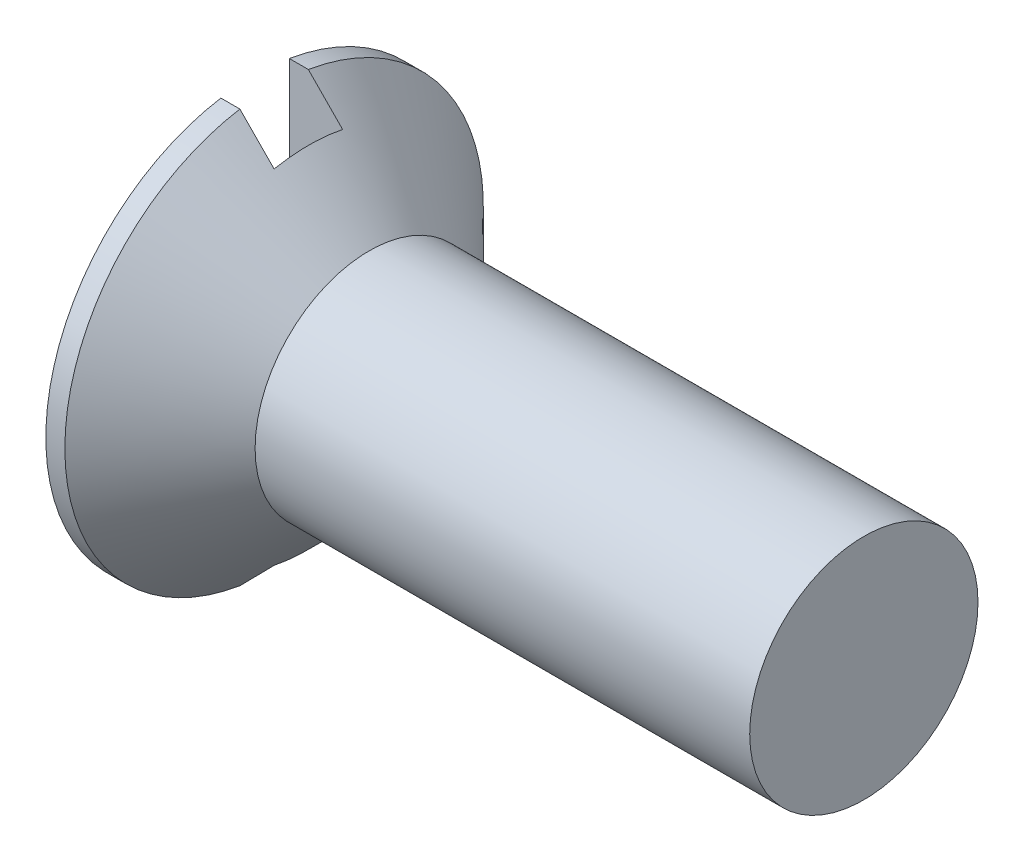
SolidWorks part; units mm, degrees
ref_plane "Plane1" through (0, 0, 0) normal (0, 0, 1) x (1, 0, 0)
ref_plane "Plane2" through (0, 0, 0) normal (0, 1, 0) x (1, 0, 0)
ref_plane "Plane3" through (0, 0, 0) normal (1, 0, 0) x (0, 0, -1)
sketch "BodySke" plane through (0, 0, 0) normal (0, 0, 1) x (1, 0, 0)
  line L0 (0, 0) -> (0, 5.5)
  line L1 (0, 5.5) -> (0.5, 5.5)
  line L2 (3, 3) -> (16, 3)
  line L3 (16, 3) -> (16, 0)
  line L4 (16, 0) -> (0, 0)
  line L5 (-6.35, 0) -> (82.55, 0) construction
  line L6 (3, -3) -> (16, -3) construction
  line L7 (0.5, -5.5) -> (3, -3) construction
  line L8 (0.5, 5.5) -> (3, 3)
  line L9 (0, -5.5) -> (0.5, -5.5) construction
  line L10 (4, 4.5875) -> (4, -4.9375) construction
  line L11 (0, 6.35) -> (0, -3.175) construction
  dimension "Diameter" = 6
  dimension "Length" = 16
  dimension "Head_ht" = 3
  dimension "Head_dia" = 11
  dimension "Head_ang" = 90
  dimension "D6" = 0.5
  dimension "Advance" = 1
  dimension "Thread_nom" = 16
revolve "Base-Revolve" add sketch "BodySke" angle 360 about L5
sketch "Sketch3" plane through (0, 0, 0) normal (-1, 0, 0) x (0, 0, 1)
  line L0 (-0.41, 3.25) -> (0.41, 3.25)
  line L1 (0.41, 3.25) -> (0.41, -3.25)
  line L2 (0.41, -3.25) -> (-0.41, -3.25)
  line L3 (-0.41, -3.25) -> (-0.41, 3.25)
  dimension "D1" = 3.25
  dimension "Cross_dia" = 6.5
  dimension "D2" = 0.41
  dimension "Cross_width" = 0.82
ref_plane "Plane4" through (2.7, 0, 0) normal (-1, 0, 0) x (0, 0, 1)
sketch "Sketch4" plane through (2.7, 0, 0) normal (-1, 0, 0) x (0, 0, 1)
  line L0 (-0.41, 1.9038) -> (0.41, 1.9038)
  line L3 (0.41, 1.9038) -> (0.41, -1.9038)
  line L4 (0.41, -1.9038) -> (-0.41, -1.9038)
  line L5 (-0.41, -1.9038) -> (-0.41, 1.9038)
  dimension "D1" = 0.82
  dimension "D2" = 3.8077
  dimension "D3" = 0.41
  dimension "D4" = 1.9038
loft "Recess" [suppressed] cut profiles "Sketch3", "Sketch4"
pattern_circular "RecPat" [suppressed] count 2 every 90 about axis through (-6.35, 0, 0) along (1, 0, 0)
sketch "RecCorSke" plane through (0, 0, 0) normal (0, 0, 1) x (1, 0, 0)
  line L0 (-3.175, 0) -> (15.875, 0) construction
  line L2 (0, 0) -> (0, 1.4693)
  line L3 (0, 1.4693) -> (2.7, 1.2805)
  line L4 (2.7, 1.2805) -> (3.1161, 0)
  line L5 (3.1161, 0) -> (0, 0)
  dimension "Diameter" = 2.561
  dimension "Depth" = 2.7
  dimension "Draft_angle" = 4
  dimension "Bottom_angle" = 18
revolve "RecessCore" [suppressed] cut sketch "RecCorSke" angle 360 about L0
sketch "Sketch5" plane through (0, 4.1645, -0.7173) normal (-1, 0, 0) x (0, 0, 1)
  line L0 (0.7173, -4.1645) -> (0.7173, 12.7) construction
  line L1 (1.6173, 1.2613) -> (1.6173, -9.5904)
  line L3 (-0.1827, -9.5904) -> (-0.1827, 1.2613)
  arc A0 (1.6173, 1.2613) -> (-0.1827, 1.2613) centre (0.7173, -4.1645) ccw
  circle A1 centre (0.7173, -4.1645) radius 5.5 construction
  arc A2 (-0.1827, -9.5904) -> (1.6173, -9.5904) centre (0.7173, -4.1645) ccw
  dimension "Slot_width" = 1.8
extrude "Slot" cut sketch "Sketch5" against normal blind 1.4
equation "\"D1@Sketch3\" = \"Cross_dia@Sketch3\" / 2"
equation "\"D2@Sketch3\" = \"Cross_width@Sketch3\" / 2"
equation "\"Depth@RecCorSke\" = \"Cross_depth@Plane4\""
equation "\"D1@Sketch4\" = \"Cross_width@Sketch3\""
equation "\"D2@Sketch4\" = \"Cross_dia@Sketch3\" - 2.0 * \"Cross_depth@Plane4\" * tan(26.5  * 0.017453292)"
equation "\"D3@Sketch4\" = \"D1@Sketch4\" / 2"
equation "\"D4@Sketch4\" = \"D2@Sketch4\" / 2"
equation "\"Thread_length@ThreadCosmetic\" = ((sgn( (\"Length@BodySke\" - \"Advance@BodySke\" * 1.0 - \"Head_ht@BodySke\" ) - \"Thread_nom@BodySke\" )-1)*( (\"Length@BodySke\" - \"Advance@BodySke\" * 1.0 - \"Head_ht@BodySke\" "
